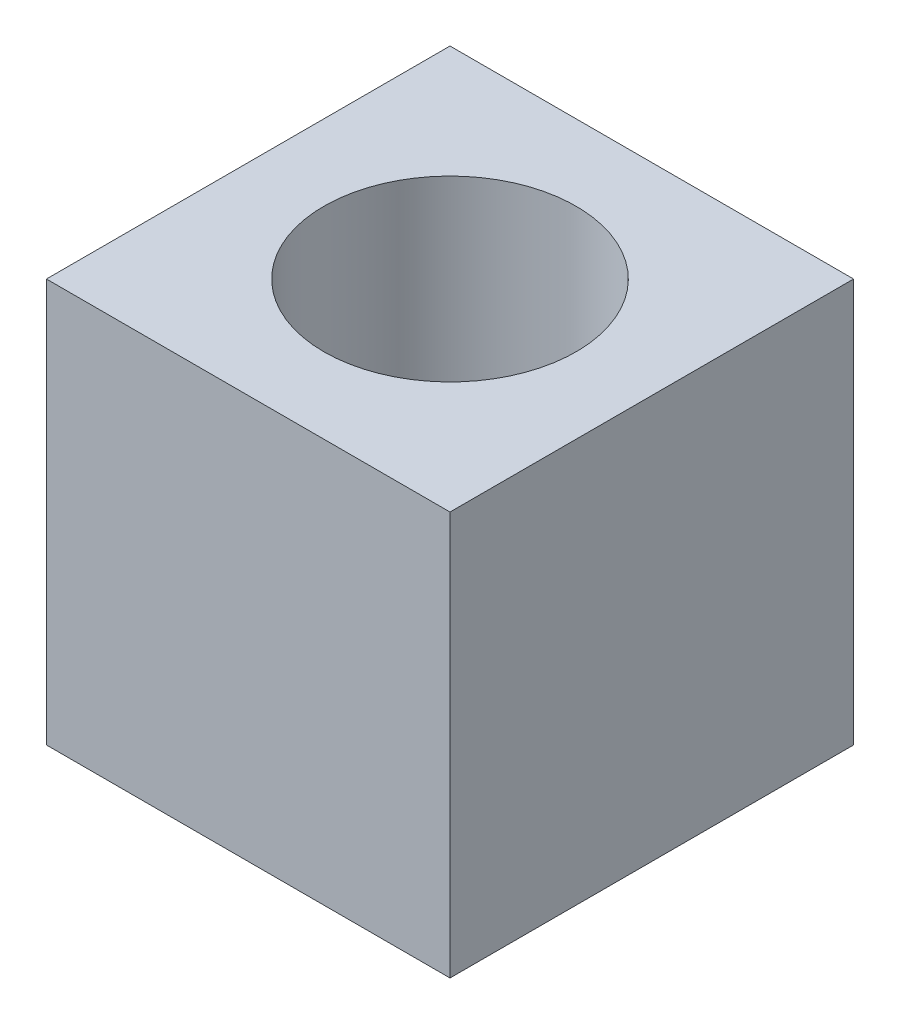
SolidWorks part; units mm, degrees
ref_plane "Front" through (0, 0, 0) normal (0, 0, 1) x (1, 0, 0)
ref_plane "Top" through (0, 0, 0) normal (0, 1, 0) x (1, 0, 0)
ref_plane "Right" through (0, 0, 0) normal (1, 0, 0) x (0, 0, -1)
sketch "Sketch3" plane through (0, 0, 0) normal (0, 0, 1) x (1, 0, 0)
  line L1 (-50.8, 0) -> (50.8, 0)
  line L2 (-50.8, 0) -> (-50.8, 101.6)
  line L3 (-50.8, 101.6) -> (50.8, 101.6)
  line L4 (50.8, 0) -> (50.8, 101.6)
  dimension "D1" = 101.6
  dimension "D2" = 101.6
extrude "Extrude1" add sketch "Sketch3" along normal mid plane 101.6
sketch "Sketch4" plane through (0, 101.6, 0) normal (0, 1, 0) x (-1, 0, 0)
  circle A0 centre (0, 0) radius 31.75
  dimension "D1" = 63.5
extrude "Cut-Extrude1" cut sketch "Sketch4" against normal through all
